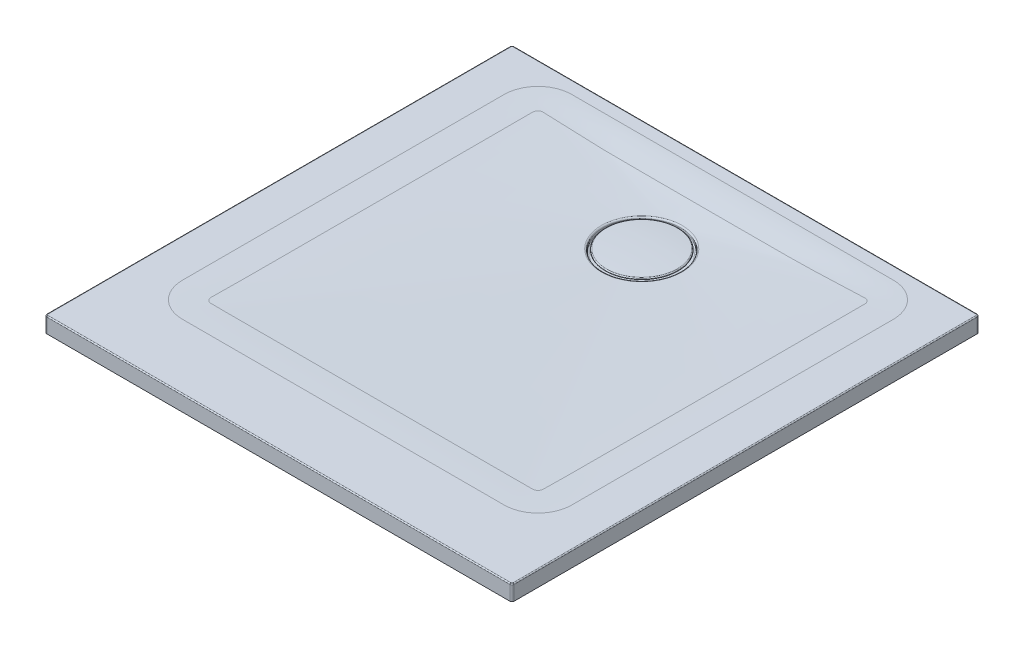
SolidWorks part; units mm, degrees
ref_plane "Płaszczyzna przednia" through (0, 0, 0) normal (0, 0, 1) x (1, 0, 0)
ref_plane "Płaszczyzna górna" through (0, 0, 0) normal (0, 1, 0) x (1, 0, 0)
ref_plane "Płaszczyzna prawa" through (0, 0, 0) normal (1, 0, 0) x (0, 0, -1)
sketch "Szkic2" plane through (0, 0, 0) normal (0, 1, 0) x (1, 0, 0)
  line L0 (0, 450) -> (0, 250) construction
  line L1 (-450, -450) -> (450, -450)
  line L2 (-450, -450) -> (-450, 450)
  line L3 (-450, 450) -> (450, 450)
  line L4 (450, -450) -> (450, 450)
  line L5 (-450, -450) -> (450, 450) construction
  line L6 (-450, 450) -> (450, -450) construction
  line L7 (-360, 410) -> (360, 410)
  line L8 (-360, 410) -> (-360, -310)
  line L9 (-360, -310) -> (360, -310)
  line L10 (360, 410) -> (360, -310)
  line L11 (-400, 450) -> (-400, -350) construction
  line L12 (-400, -350) -> (400, -350) construction
  line L13 (400, -350) -> (400, 450) construction
  circle A0 centre (0, 250) radius 75
  point P0 (0, 0)
  point P11 (0, 410)
  point P16 (0, -350)
  dimension "D9" = 150
  dimension "D1" = 900
  dimension "D2" = 900
  dimension "D3" = 40
  dimension "D4" = 90
  dimension "D5" = 40
  dimension "D6" = 50
  dimension "D7" = 800
  dimension "D8" = 200
  dimension "D10" = 800
sketch "Szkic3" plane through (0, 0, 0) normal (0, 1, 0) x (1, 0, 0)
  line L0 (-450, -450) -> (-450, 450) construction
  line L1 (-450, -450) -> (450, -450) construction
  line L2 (450, -450) -> (450, 450) construction
  line L3 (-450, 450) -> (450, 450) construction
  line L4 (-360, 410) -> (-360, -310) construction
  line L5 (-360, 410) -> (360, 410) construction
  line L6 (360, 410) -> (360, -310) construction
  line L7 (-360, -310) -> (360, -310) construction
  line L8 (-450, -450) -> (-450, 450)
  line L9 (-450, -450) -> (450, -450)
  line L10 (450, -450) -> (450, 450)
  line L11 (-450, 450) -> (450, 450)
  line L12 (-360, 360) -> (-360, -260)
  line L13 (-310, 410) -> (310, 410)
  line L14 (360, 360) -> (360, -260)
  line L15 (-310, -310) -> (310, -310)
  arc A0 (360, 360) -> (310, 410) centre (310, 360) ccw
  arc A1 (-310, 410) -> (-360, 360) centre (-310, 360) ccw
  arc A2 (310, -310) -> (360, -260) centre (310, -260) ccw
  arc A3 (-310, -310) -> (-360, -260) centre (-310, -260) cw
  dimension "D1" = 50
surface "Powierzchnia-Płaszczyzna1" sketch "Szkic3"
sketch "Szkic4" plane through (0, 0, 0) normal (0, 1, 0) x (1, 0, 0)
  line L0 (-360, 410) -> (-360, -310) construction
  line L1 (-360, -310) -> (360, -310) construction
  line L2 (360, 410) -> (360, -310) construction
  line L3 (-360, 410) -> (360, 410) construction
  line L4 (-360, 410) -> (-360, -310)
  line L5 (-360, -310) -> (360, -310)
  line L6 (360, 410) -> (360, -310)
  line L7 (-360, 410) -> (360, 410)
ref_plane "korek" through (0, -15, 0) normal (0, 1, 0) x (-1, 0, 0)
sketch "Szkic5" plane through (0, -15, 0) normal (0, 1, 0) x (-1, 0, 0)
  circle A0 centre (0, -250) radius 75 construction
  circle A1 centre (0, -250) radius 75
surface "Powierzchnia-Wyciągnięcie po profilach2"
surface "Powierzchnia-Połącz1"
sketch "Szkic7" plane through (0, 0, 0) normal (0, 1, 0) x (1, 0, 0)
  line L27 (310, 370) -> (-310, 370)
  line L28 (-320, 360) -> (-320, -260)
  line L29 (-310, -270) -> (310, -270)
  line L30 (320, -260) -> (320, 360)
  line L31 (310, 370) -> (-310, 370)
  line L32 (-320, 360) -> (-320, -260)
  line L33 (-310, -270) -> (310, -270)
  line L34 (320, -260) -> (320, 360)
  line L35 (310, 425) -> (-310, 425)
  line L36 (-375, 360) -> (-375, -260)
  line L37 (-310, -325) -> (310, -325)
  line L38 (375, -260) -> (375, 360)
  line L39 (310, 425) -> (-310, 425)
  line L40 (-375, 360) -> (-375, -260)
  line L41 (-310, -325) -> (310, -325)
  line L42 (375, -260) -> (375, 360)
  arc A0 (320, -260) -> (310, -270) centre (310, -260) cw
  arc A1 (-320, -260) -> (-310, -270) centre (-310, -260) ccw
  arc A2 (320, 360) -> (310, 370) centre (310, 360) ccw
  arc A3 (-320, 360) -> (-310, 370) centre (-310, 360) cw
  spline S23 degree 3 poles (-642.4276, 88.4615) (143.2601, 258.8094) (326.8324, 326.6094) (319.7449, 362.2677) (319.6659, 362.5844) (319.4756, 363.2123) (319.364, 363.5244) (318.988, 364.4324) (318.6811, 365.0065) (318.1374, 365.8215) (317.9415, 366.0862) (317.5236, 366.5958) (317.3038, 366.8383) (316.6124, 367.53) (316.1095, 367.944) (315.2903, 368.4923) (315.0066, 368.6627) (314.4297, 368.9712) (314.1353, 369.1108) (313.5342, 369.3603) (313.2277, 369.4705) (312.6023, 369.661) (312.2821, 369.7415) (258.0026, 380.6172) (153.6608, -62.3452) (39.61, -592.7472) knots -6.791093 -6.791093 -6.791093 -6.791093 0.125 0.125 0.1875 0.1875 0.25 0.25 0.375 0.375 0.4375 0.4375 0.5 0.5 0.625 0.625 0.6875 0.6875 0.75 0.75 0.8125 0.8125 0.875 0.875 11.317642 11.317642 11.317642 11.317642 only from (320, 360) to (310, 370)
  spline S24 degree 3 poles (-31.4291, -590.4134) (-199.2409, 165.8714) (-274.2436, 377.3191) (-312.2675, 369.7448) (-312.5843, 369.6659) (-313.2122, 369.4758) (-313.5242, 369.3641) (-314.4322, 368.9882) (-315.0062, 368.6811) (-315.8212, 368.1376) (-316.0859, 367.9416) (-316.5956, 367.5238) (-316.838, 367.304) (-317.5298, 366.6127) (-317.9438, 366.1098) (-318.4921, 365.2908) (-318.6624, 365.007) (-318.9711, 364.4301) (-319.1106, 364.1356) (-319.3602, 363.5345) (-319.4703, 363.2278) (-319.6609, 362.6025) (-319.7416, 362.2823) (-328.6821, 317.5611) (-33.1297, 239.3562) (650.2866, 118.0792) knots -7.255081 -7.255081 -7.255081 -7.255081 0.125 0.125 0.1875 0.1875 0.25 0.25 0.375 0.375 0.4375 0.4375 0.5 0.5 0.625 0.625 0.6875 0.6875 0.75 0.75 0.8125 0.8125 0.875 0.875 9.466633 9.466633 9.466633 9.466633 only from (-310, 370) to (-320, 360)
  spline S25 degree 3 poles (642.4251, 11.5379) (-143.2606, -158.8096) (-326.8324, -226.6094) (-319.7449, -262.2677) (-319.6659, -262.5844) (-319.4756, -263.2123) (-319.364, -263.5244) (-318.988, -264.4324) (-318.6811, -265.0065) (-318.1374, -265.8215) (-317.9415, -266.0862) (-317.5236, -266.5958) (-317.3038, -266.8383) (-316.6124, -267.53) (-316.1095, -267.944) (-315.2903, -268.4923) (-315.0066, -268.6627) (-314.4297, -268.9712) (-314.1353, -269.1108) (-313.5342, -269.3603) (-313.2277, -269.4705) (-312.6023, -269.661) (-312.2821, -269.7415) (-258.0027, -280.6172) (-153.661, 162.3443) (-39.6103, 692.7457) knots -6.791085 -6.791085 -6.791085 -6.791085 0.125 0.125 0.1875 0.1875 0.25 0.25 0.375 0.375 0.4375 0.4375 0.5 0.5 0.625 0.625 0.6875 0.6875 0.75 0.75 0.8125 0.8125 0.875 0.875 11.317632 11.317632 11.317632 11.317632 only from (-320, -260) to (-310, -270)
  spline S26 degree 3 poles (31.4291, 690.4136) (199.2409, -65.8714) (274.2436, -277.3191) (312.2675, -269.7448) (312.5843, -269.6659) (313.2122, -269.4758) (313.5242, -269.3641) (314.4322, -268.9882) (315.0062, -268.6811) (315.8212, -268.1376) (316.0859, -267.9416) (316.5956, -267.5238) (316.838, -267.304) (317.5298, -266.6127) (317.9438, -266.1098) (318.4921, -265.2908) (318.6624, -265.007) (318.9711, -264.4301) (319.1106, -264.1356) (319.3602, -263.5345) (319.4703, -263.2278) (319.6609, -262.6025) (319.7416, -262.2823) (328.6821, -217.5611) (33.1297, -139.3562) (-650.2867, -18.0791) knots -7.255081 -7.255081 -7.255081 -7.255081 0.125 0.125 0.1875 0.1875 0.25 0.25 0.375 0.375 0.4375 0.4375 0.5 0.5 0.625 0.625 0.6875 0.6875 0.75 0.75 0.8125 0.8125 0.875 0.875 9.466633 9.466633 9.466633 9.466633 only from (310, -270) to (320, -260)
  spline S31 degree 3 poles (-1478.3719, -367.9796) (-12.3252, 23.4113) (400.9923, 235.5458) (373.3422, 374.7391) (372.8283, 376.7975) (371.9013, 379.8585) (371.5657, 380.8761) (370.8439, 382.8947) (370.4595, 383.8909) (368.4227, 388.8085) (366.4282, 392.5403) (363.4834, 396.9548) (362.8716, 397.825) (361.6017, 399.5398) (360.9418, 400.3866) (358.9049, 402.8707) (357.4759, 404.4469) (352.9823, 408.9436) (349.7133, 411.6344) (345.2769, 414.6047) (344.3695, 415.1805) (342.535, 416.2817) (341.6076, 416.8075) (338.7954, 418.3123) (336.881, 419.219) (332.9737, 420.8414) (330.9809, 421.5575) (327.9321, 422.4866) (326.9059, 422.7721) (324.8332, 423.2939) (323.7848, 423.5304) (320.636, 424.1598) (318.525, 424.4739) (182.5528, 437.9195) (2.9465, 39.3703) (-300.1299, -1470.346) knots -4.003656 -4.003656 -4.003656 -4.003656 0.125 0.125 0.1875 0.1875 0.21875 0.21875 0.25 0.25 0.375 0.375 0.40625 0.40625 0.4375 0.4375 0.5 0.5 0.625 0.625 0.65625 0.65625 0.6875 0.6875 0.75 0.75 0.8125 0.8125 0.84375 0.84375 0.875 0.875 0.9375 0.9375 4.878814 4.878814 4.878814 4.878814 only from (375, 360) to (310, 425)
  spline S32 degree 3 poles (374.7456, -1445.8091) (-14.0559, 107.9229) (-194.2444, 436.7286) (-318.4946, 424.4775) (-320.5876, 424.167) (-324.7389, 423.3421) (-326.7973, 422.8284) (-329.8583, 421.9015) (-330.8758, 421.5658) (-332.8944, 420.844) (-333.8907, 420.4596) (-338.8083, 418.4228) (-342.54, 416.4283) (-346.9545, 413.4835) (-347.8248, 412.8718) (-349.5396, 411.6019) (-350.3863, 410.9421) (-352.8705, 408.9052) (-354.4466, 407.4761) (-358.9434, 402.9826) (-361.6341, 399.7136) (-364.6045, 395.2774) (-365.1802, 394.3699) (-366.2814, 392.5354) (-366.8073, 391.6079) (-368.3122, 388.7958) (-369.2188, 386.8813) (-370.8414, 382.9739) (-371.5573, 380.9811) (-372.4865, 377.9323) (-372.7721, 376.9061) (-373.2939, 374.8334) (-373.5304, 373.785) (-405.6111, 213.2358) (165.8733, -13.3013) (1494.0077, -323.9081) knots -3.554608 -3.554608 -3.554608 -3.554608 0.0625 0.0625 0.125 0.125 0.1875 0.1875 0.21875 0.21875 0.25 0.25 0.375 0.375 0.40625 0.40625 0.4375 0.4375 0.5 0.5 0.625 0.625 0.65625 0.65625 0.6875 0.6875 0.75 0.75 0.8125 0.8125 0.84375 0.84375 0.875 0.875 5.623629 5.623629 5.623629 5.623629 only from (-310, 425) to (-375, 360)
  spline S33 degree 3 poles (1478.372, 467.9796) (12.3252, 76.5887) (-400.9923, -135.5458) (-373.3422, -274.7391) (-372.8283, -276.7975) (-371.9013, -279.8585) (-371.5657, -280.8761) (-370.8439, -282.8947) (-370.4595, -283.8909) (-368.4227, -288.8085) (-366.4282, -292.5403) (-363.4834, -296.9548) (-362.8716, -297.825) (-361.6017, -299.5398) (-360.9418, -300.3866) (-358.9049, -302.8707) (-357.4759, -304.4469) (-352.9823, -308.9436) (-349.7133, -311.6344) (-345.2769, -314.6047) (-344.3695, -315.1805) (-342.535, -316.2817) (-341.6076, -316.8075) (-338.7954, -318.3123) (-336.881, -319.219) (-332.9737, -320.8414) (-330.9809, -321.5575) (-327.9321, -322.4866) (-326.9059, -322.7721) (-324.8332, -323.2939) (-323.7848, -323.5304) (-320.636, -324.1598) (-318.525, -324.4739) (-182.5528, -337.9195) (-2.9465, 60.6297) (300.1299, 1570.346) knots -4.003656 -4.003656 -4.003656 -4.003656 0.125 0.125 0.1875 0.1875 0.21875 0.21875 0.25 0.25 0.375 0.375 0.40625 0.40625 0.4375 0.4375 0.5 0.5 0.625 0.625 0.65625 0.65625 0.6875 0.6875 0.75 0.75 0.8125 0.8125 0.84375 0.84375 0.875 0.875 0.9375 0.9375 4.878814 4.878814 4.878814 4.878814 only from (-375, -260) to (-310, -325)
  spline S34 degree 3 poles (-374.7456, 1545.8091) (14.0559, -7.9229) (194.2444, -336.7286) (318.4946, -324.4775) (320.5876, -324.167) (324.7389, -323.3421) (326.7973, -322.8284) (329.8583, -321.9015) (330.8758, -321.5658) (332.8944, -320.844) (333.8907, -320.4596) (338.8083, -318.4228) (342.54, -316.4283) (346.9545, -313.4835) (347.8248, -312.8718) (349.5396, -311.6019) (350.3863, -310.9421) (352.8705, -308.9052) (354.4466, -307.4761) (358.9434, -302.9826) (361.6341, -299.7136) (364.6045, -295.2774) (365.1802, -294.3699) (366.2814, -292.5354) (366.8073, -291.6079) (368.3122, -288.7958) (369.2188, -286.8813) (370.8414, -282.9739) (371.5573, -280.9811) (372.4865, -277.9323) (372.7721, -276.9061) (373.2939, -274.8334) (373.5304, -273.785) (405.6111, -113.2358) (-165.8733, 113.3013) (-1494.0077, 423.9081) knots -3.554608 -3.554608 -3.554608 -3.554608 0.0625 0.0625 0.125 0.125 0.1875 0.1875 0.21875 0.21875 0.25 0.25 0.375 0.375 0.40625 0.40625 0.4375 0.4375 0.5 0.5 0.625 0.625 0.65625 0.65625 0.6875 0.6875 0.75 0.75 0.8125 0.8125 0.84375 0.84375 0.875 0.875 5.623629 5.623629 5.623629 5.623629 only from (310, -325) to (375, -260)
  spline S35 degree 3 poles (375, 360) (375, 364.2918) (374.5792, 368.512) (373.3422, 374.7391) (372.8283, 376.7975) (371.9013, 379.8585) (371.5657, 380.8761) (370.8439, 382.8947) (370.4595, 383.8909) (368.4227, 388.8085) (366.4282, 392.5403) (363.4834, 396.9548) (362.8716, 397.825) (361.6017, 399.5398) (360.9418, 400.3866) (358.9049, 402.8707) (357.4759, 404.4469) (352.9823, 408.9436) (349.7133, 411.6344) (345.2769, 414.6047) (344.3695, 415.1805) (342.535, 416.2817) (341.6076, 416.8075) (338.7954, 418.3123) (336.881, 419.219) (332.9737, 420.8414) (330.9809, 421.5575) (327.9321, 422.4866) (326.9059, 422.7721) (324.8332, 423.2939) (323.7848, 423.5304) (320.636, 424.1598) (318.525, 424.4739) (314.2799, 424.8937) (312.1459, 425) (310, 425) knots 0 0 0 0 0.125 0.125 0.1875 0.1875 0.21875 0.21875 0.25 0.25 0.375 0.375 0.40625 0.40625 0.4375 0.4375 0.5 0.5 0.625 0.625 0.65625 0.65625 0.6875 0.6875 0.75 0.75 0.8125 0.8125 0.84375 0.84375 0.875 0.875 0.9375 0.9375 1 1 1 1
  spline S36 degree 3 poles (-310, 425) (-312.1459, 425) (-314.2737, 424.8937) (-318.4946, 424.4775) (-320.5876, 424.167) (-324.7389, 423.3421) (-326.7973, 422.8284) (-329.8583, 421.9015) (-330.8758, 421.5658) (-332.8944, 420.844) (-333.8907, 420.4596) (-338.8083, 418.4228) (-342.54, 416.4283) (-346.9545, 413.4835) (-347.8248, 412.8718) (-349.5396, 411.6019) (-350.3863, 410.9421) (-352.8705, 408.9052) (-354.4466, 407.4761) (-358.9434, 402.9826) (-361.6341, 399.7136) (-364.6045, 395.2774) (-365.1802, 394.3699) (-366.2814, 392.5354) (-366.8073, 391.6079) (-368.3122, 388.7958) (-369.2188, 386.8813) (-370.8414, 382.9739) (-371.5573, 380.9811) (-372.4865, 377.9323) (-372.7721, 376.9061) (-373.2939, 374.8334) (-373.5304, 373.785) (-374.5791, 368.5368) (-375, 364.2918) (-375, 360) knots 0 0 0 0 0.0625 0.0625 0.125 0.125 0.1875 0.1875 0.21875 0.21875 0.25 0.25 0.375 0.375 0.40625 0.40625 0.4375 0.4375 0.5 0.5 0.625 0.625 0.65625 0.65625 0.6875 0.6875 0.75 0.75 0.8125 0.8125 0.84375 0.84375 0.875 0.875 1 1 1 1
  spline S37 degree 3 poles (-375, -260) (-375, -264.2918) (-374.5792, -268.512) (-373.3422, -274.7391) (-372.8283, -276.7975) (-371.9013, -279.8585) (-371.5657, -280.8761) (-370.8439, -282.8947) (-370.4595, -283.8909) (-368.4227, -288.8085) (-366.4282, -292.5403) (-363.4834, -296.9548) (-362.8716, -297.825) (-361.6017, -299.5398) (-360.9418, -300.3866) (-358.9049, -302.8707) (-357.4759, -304.4469) (-352.9823, -308.9436) (-349.7133, -311.6344) (-345.2769, -314.6047) (-344.3695, -315.1805) (-342.535, -316.2817) (-341.6076, -316.8075) (-338.7954, -318.3123) (-336.881, -319.219) (-332.9737, -320.8414) (-330.9809, -321.5575) (-327.9321, -322.4866) (-326.9059, -322.7721) (-324.8332, -323.2939) (-323.7848, -323.5304) (-320.636, -324.1598) (-318.525, -324.4739) (-314.2799, -324.8937) (-312.1459, -325) (-310, -325) knots 0 0 0 0 0.125 0.125 0.1875 0.1875 0.21875 0.21875 0.25 0.25 0.375 0.375 0.40625 0.40625 0.4375 0.4375 0.5 0.5 0.625 0.625 0.65625 0.65625 0.6875 0.6875 0.75 0.75 0.8125 0.8125 0.84375 0.84375 0.875 0.875 0.9375 0.9375 1 1 1 1
  spline S38 degree 3 poles (310, -325) (312.1459, -325) (314.2737, -324.8937) (318.4946, -324.4775) (320.5876, -324.167) (324.7389, -323.3421) (326.7973, -322.8284) (329.8583, -321.9015) (330.8758, -321.5658) (332.8944, -320.844) (333.8907, -320.4596) (338.8083, -318.4228) (342.54, -316.4283) (346.9545, -313.4835) (347.8248, -312.8718) (349.5396, -311.6019) (350.3863, -310.9421) (352.8705, -308.9052) (354.4466, -307.4761) (358.9434, -302.9826) (361.6341, -299.7136) (364.6045, -295.2774) (365.1802, -294.3699) (366.2814, -292.5354) (366.8073, -291.6079) (368.3122, -288.7958) (369.2188, -286.8813) (370.8414, -282.9739) (371.5573, -280.9811) (372.4865, -277.9323) (372.7721, -276.9061) (373.2939, -274.8334) (373.5304, -273.785) (374.5791, -268.5368) (375, -264.2918) (375, -260) knots 0 0 0 0 0.0625 0.0625 0.125 0.125 0.1875 0.1875 0.21875 0.21875 0.25 0.25 0.375 0.375 0.40625 0.40625 0.4375 0.4375 0.5 0.5 0.625 0.625 0.65625 0.65625 0.6875 0.6875 0.75 0.75 0.8125 0.8125 0.84375 0.84375 0.875 0.875 1 1 1 1
  dimension "D3" = 10
  dimension "D1" = 40
  dimension "D2" = 15
other "Usuń ścianę1"
other "Granica-Powierzchnia1"
surface "Powierzchnia-Połącz2"
sketch "Szkic9" plane through (0, 0, 0) normal (0, 1, 0) x (1, 0, 0)
  line L0 (-450, -450) -> (450, -450) construction
  line L1 (-450, -450) -> (-450, 450) construction
  line L2 (450, -450) -> (450, 450) construction
  line L3 (-450, 450) -> (450, 450) construction
  line L4 (-450, -450) -> (450, -450)
  line L5 (-450, -450) -> (-450, 450)
  line L6 (450, -450) -> (450, 450)
  line L7 (-450, 450) -> (450, 450)
surface "Powierzchnia-Wyciągnięcie1" sketch "Szkic9" parameters "D1"=30
sketch "Szkic8" plane through (0, 0, 0) normal (1, 0, 0) x (0, 0, -1)
  line L0 (250, 0) -> (250, -30) construction
  line L1 (174.9999, -15) -> (175.2968, -23.5)
  line L4 (175.2968, -23.5) -> (198, -24.0945)
  line L5 (175.2968, -23.5) -> (250, -23.5) construction
  line L6 (198, -24.0945) -> (198, -30) construction
  line L7 (250, -30) -> (175.2968, -30) construction
  line L8 (175.2968, -30) -> (175.2968, -23.5) construction
  line L9 (205, -28) -> (205, -30)
  line L10 (198, -24.0945) -> (205, -28)
  dimension "D1" = 30
  dimension "D2" = 8.5
  dimension "D3" = 2
  dimension "D4" = 1.5
  dimension "D5" = 52
  dimension "D6" = 45
  dimension "D7" = 2
surface "Powierzchnia-Obrót1" sketch "Szkic8" parameters "D1"=360
surface "Powierzchnia-Płaszczyzna2"
surface "Powierzchnia-Połącz3"
fillet "Zaokrąglenie4" radius 4 4 edges at (-450, -15, -450) (450, -15, -450) (-450, -15, 450) (450, -15, 450)
fillet "Zaokrąglenie5" radius 3 3 edges at (0, -24.0945, -302) (0, -23.5, -324.7032)
fillet "Zaokrąglenie6" radius 2 9 edges at (448.8284, 0, 448.8284) (0, 0, 450) (-448.8284, 0, 448.8284) (-450, 0, 0) (-448.8284, 0, -448.8284) (0, 0, -450) (448.8284, 0, -448.8284) (450, 0, 0) (0, -28, -295)
sketch "Szkic11" plane through (0, 0, 0) normal (1, 0, 0) x (0, 0, -1)
  line L0 (250, 0) -> (250, -30) construction
  line L1 (-446, -30) -> (446, -30) construction
  line L2 (250, -17) -> (250, -11.5)
  line L14 (320, -11.5) -> (320, -14.5) construction
  line L16 (320, -17) -> (250, -17)
  line L18 (320, -17) -> (320, -16.3377)
  line L19 (250, -11.5) -> (320, -11.5) construction
  arc A0 (320, -16.3377) -> (318.1666, -14.3446) centre (318, -16.3377) ccw
  arc A6 (318.1666, -14.3446) -> (250, -11.5) centre (250, -829.6667) ccw
  dimension "D2" = 2
  dimension "D8" = 2.5
  dimension "D9" = 17
  dimension "D10" = 5.5
  dimension "D11" = 70
revolve "Obrót1" add sketch "Szkic11" angle 360 about L0
